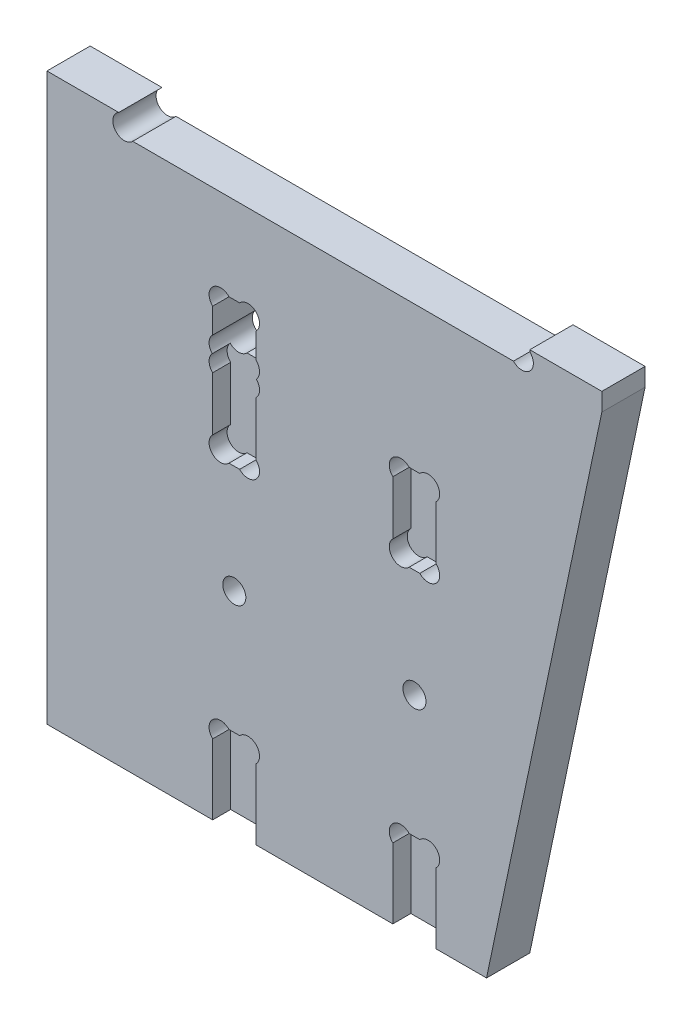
SolidWorks part; units mm, degrees
ref_plane "Plan de face" through (0, 0, 0) normal (0, 0, 1) x (1, 0, 0)
ref_plane "Plan de dessus" through (0, 0, 0) normal (0, 1, 0) x (1, 0, 0)
ref_plane "Plan de droite" through (0, 0, 0) normal (1, 0, 0) x (0, 0, -1)
sketch "Esquisse1" plane through (0, 0, 0) normal (0, 0, 1) x (1, 0, 0)
  line L0 (0, 65.0081) -> (0, -9.9384) construction
  line L1 (11.7393, 0) -> (-31.8718, 0) construction
  line L2 (9.1967, 12) -> (-23.9296, 12) construction
  line L3 (9.1967, 42) -> (-19.8178, 42) construction
  line L4 (9.1967, 54) -> (-19.8178, 54) construction
  line L5 (-6, 65.0081) -> (-6, -9.9384) construction
  line L6 (2.8612, 42) -> (2.8612, 12) construction
  line L7 (1.6817, 48) -> (-10.3124, 48) construction
  line L8 (-2.2619, 54) -> (-3.7381, 54) construction
  line L9 (0, 51.7381) -> (0, 44.2619)
  line L10 (-2.2619, 42) -> (-3.7381, 42)
  line L11 (-6, 51.7381) -> (-6, 44.2619)
  line L12 (-3, 54.8011) -> (-3, 40.0837) construction
  line L13 (2.8612, 27) -> (-11.4211, 27) construction
  line L14 (25.4842, 10) -> (-16.2282, 10) construction
  line L15 (-6, -2) -> (-6, 7.7381)
  line L16 (-3.7381, 10) -> (-2.2619, 10)
  line L17 (38.4169, -2) -> (-46.0794, -2) construction
  line L18 (17, 79.5439) -> (17, -29.3046) construction
  line L19 (-31, 83.2548) -> (-31, -44.3973) construction
  line L20 (57.319, 74) -> (-78.5779, 74) construction
  line L21 (23, 62.8857) -> (23, -51.6502) construction
  line L22 (30, 62.8857) -> (30, -54.9729) construction
  line L23 (-31, 0) -> (-31, 74)
  line L24 (30, -2) -> (46, 74)
  line L25 (33.7381, 74) -> (-19.0967, 74)
  line L26 (0, 7.7381) -> (0, -2)
  line L27 (0, -2) -> (17, -2)
  line L28 (17, -2) -> (17, 7.7381)
  line L29 (3.4839, 62) -> (-9.6947, 62) construction
  line L30 (0, 51.7381) -> (0, 59.7381)
  line L31 (-2.2619, 62) -> (-3.7381, 62)
  line L32 (-6, 59.7381) -> (-6, 51.7381)
  line L33 (17, 6.0366) -> (0, 6) construction
  line L34 (8.5, 9.2575) -> (8.5, 3.2101) construction
  line L35 (19.2619, 10) -> (20.7381, 10)
  line L36 (23, 7.7381) -> (23, -2)
  line L37 (23, -2) -> (30, -2)
  line L38 (-6, -2) -> (-31, -2)
  line L39 (17, 51.7381) -> (17, 44.2619)
  line L40 (23, 51.7381) -> (23, 44.2619)
  line L41 (19.2619, 42) -> (20.7381, 42)
  line L42 (20, 42) -> (20, 46.358) construction
  line L43 (20.7381, 54) -> (19.2619, 54)
  line L44 (20, 42) -> (20, 12) construction
  line L45 (-31, -2) -> (-31, 0)
  line L46 (-3, 10) -> (-3, 2.1006) construction
  line L47 (-42.5287, 80) -> (78.4783, 80) construction
  line L48 (-21, 86.0943) -> (-21, 72.2146) construction
  line L49 (7.3207, 75.5379) -> (7.3207, 90.5905) construction
  line L50 (36, 88.6356) -> (36, 76.2619) construction
  line L51 (-31, 74) -> (-31, 80)
  line L52 (-31, 80) -> (-21, 80)
  line L53 (-21, 80) -> (-21, 76.5178)
  line L54 (46, 74) -> (46, 80)
  line L55 (46, 80) -> (36, 80)
  line L56 (36, 80) -> (36, 76.2619)
  line L57 (36, 74) -> (36, 72.2146) construction
  arc A0 (0, 51.7381) -> (-2.2619, 54) centre (-1.1, 52.9) ccw construction
  arc A1 (0, 59.7381) -> (-2.2619, 62) centre (-1.1, 60.9) ccw
  arc A2 (-6, 44.2619) -> (-3.7381, 42) centre (-4.9, 43.1) ccw
  arc A3 (0, 44.2619) -> (-2.2619, 42) centre (-1.1, 43.1) cw
  arc A4 (-3.7381, 10) -> (-6, 7.7381) centre (-4.9, 8.9) ccw
  arc A5 (-2.2619, 10) -> (0, 7.7381) centre (-1.1, 8.9) cw
  arc A6 (-6, 59.7381) -> (-3.7381, 62) centre (-4.9, 60.9) cw
  arc A7 (20.7381, 10) -> (23, 7.7381) centre (21.9, 8.9) cw
  arc A8 (19.2619, 10) -> (17, 7.7381) centre (18.1, 8.9) ccw
  arc A9 (17, 51.7381) -> (19.2619, 54) centre (18.1, 52.9) cw construction
  arc A10 (23, 44.2619) -> (20.7381, 42) centre (21.9, 43.1) cw
  arc A11 (17, 44.2619) -> (19.2619, 42) centre (18.1, 43.1) ccw
  arc A12 (19.2619, 54) -> (17, 51.7381) centre (18.1, 52.9) ccw
  arc A13 (20.7381, 54) -> (23, 51.7381) centre (21.9, 52.9) cw
  circle A14 centre (20, 27) radius 1.6
  circle A15 centre (-3, 27) radius 1.6
  arc A16 (33.7381, 74) -> (36, 76.2619) centre (34.9, 75.1) ccw
  arc A17 (-19.0967, 74) -> (-21, 76.5178) centre (-20.2586, 75.1) cw
  dimension "D3" = 2
  dimension "D10" = 20
  dimension "D12" = 8
  dimension "D7" = 1.1
  dimension "D13" = 1.1
  dimension "D16" = 1.1
  dimension "D22" = 1.1
  dimension "D1" = 54
  dimension "D2" = 12
  dimension "D4" = 6
  dimension "D5" = 17
  dimension "D6" = 6
  dimension "D8" = 1.1
  dimension "D9" = 7
  dimension "D11" = 25
  dimension "D14" = 1.1
  dimension "D15" = 2
  dimension "D17" = 1.1
  dimension "D18" = 77
  dimension "D19" = 6
  dimension "D20" = 10
  dimension "D21" = 10
  dimension "D23" = 1.1
sketch "Esquisse2" plane through (0, 0, 0) normal (0, 0, 1) x (1, 0, 0)
  line L3 (-31, 80) -> (-21, 80) construction
  line L19 (-21, 80) -> (-21, 76.5178) construction
  line L20 (33.7381, 74) -> (-19.0967, 74) construction
  line L21 (36, 80) -> (36, 76.2619) construction
  line L22 (46, 80) -> (36, 80) construction
  line L23 (46, 74) -> (46, 80) construction
  line L24 (30, -2) -> (46, 74) construction
  line L25 (-31, 0) -> (-31, 74) construction
  line L26 (-31, 74) -> (-31, 80) construction
  line L27 (-31, -2) -> (-31, 0) construction
  line L28 (-6, -2) -> (-31, -2) construction
  line L29 (23, -2) -> (30, -2) construction
  line L30 (-31, 80) -> (-21, 80)
  line L31 (-21, 80) -> (-21, 76.5178)
  line L32 (33.7381, 74) -> (-19.0967, 74)
  line L33 (36, 80) -> (36, 76.2619)
  line L34 (46, 80) -> (36, 80)
  line L35 (46, 74) -> (46, 80)
  line L36 (30, -2) -> (46, 74)
  line L37 (-31, 0) -> (-31, 74)
  line L38 (-31, 74) -> (-31, 80)
  line L39 (-31, -2) -> (-31, 0)
  line L40 (-6, -2) -> (-31, -2)
  line L41 (23, -2) -> (30, -2)
  line L42 (23, -2) -> (-6, -2)
  arc A3 (-21, 76.5178) -> (-19.0967, 74) centre (-20.2586, 75.1) ccw construction
  arc A5 (33.7381, 74) -> (36, 76.2619) centre (34.9, 75.1) ccw construction
  arc A10 (-21, 76.5178) -> (-19.0967, 74) centre (-20.2586, 75.1) ccw
  arc A11 (33.7381, 74) -> (36, 76.2619) centre (34.9, 75.1) ccw
extrude "Boss.-Extru.1" add sketch "Esquisse2" against normal blind 6
sketch "Esquisse5" plane through (0, 0, 0) normal (0, 0, 1) x (1, 0, 0)
  circle A1 centre (20, 27) radius 1.6 construction
  circle A2 centre (-5, 27) radius 1.6
  circle A3 centre (20, 27) radius 1.6
extrude "Enlèv. mat.-Extru.3" cut sketch "Esquisse5" against normal through all
sketch "Esquisse6" plane through (0, 0, 0) normal (0, 0, 1) x (1, 0, 0)
  line L4 (20.7381, 54) -> (19.2619, 54) construction
  line L5 (23, 51.7381) -> (23, 44.2619) construction
  line L6 (17, 51.7381) -> (17, 44.2619) construction
  line L7 (19.2619, 42) -> (20.7381, 42) construction
  line L8 (-5.7381, 54) -> (-4.2619, 54)
  line L9 (-2, 51.7381) -> (-2, 44.2619)
  line L10 (-8, 51.7381) -> (-8, 44.2619)
  line L11 (-4.2619, 42) -> (-5.7381, 42)
  line L12 (20.7381, 54) -> (19.2619, 54)
  line L13 (23, 51.7381) -> (23, 44.2619)
  line L14 (17, 51.7381) -> (17, 44.2619)
  line L15 (19.2619, 42) -> (20.7381, 42)
  line L18 (-5, 47.4424) -> (-5, 57.5634) construction
  line L19 (19.2619, 10) -> (20.7381, 10) construction
  line L20 (23, 7.7381) -> (23, -2) construction
  line L21 (17, -2) -> (17, 7.7381) construction
  line L25 (19.2619, 10) -> (20.7381, 10)
  line L26 (23, 7.7381) -> (23, -2)
  line L27 (17, -2) -> (17, 7.7381)
  line L28 (-2, 7.7381) -> (-2, -2)
  line L29 (-8, -2) -> (-8, 7.7381)
  line L30 (-5.7381, 10) -> (-4.2619, 10)
  line L31 (-8, -2) -> (-8, -4.5)
  line L33 (-8, -4.5) -> (-2, -4.5)
  line L35 (-2, -4.5) -> (-2, -2)
  line L36 (-6, -2) -> (-31, -2) construction
  line L37 (17, -2) -> (17, -4.5)
  line L38 (17, 79.5439) -> (17, -29.3046) construction
  line L39 (17, -4.5) -> (23, -4.5)
  line L40 (23, 62.8857) -> (23, -51.6502) construction
  line L41 (23, -4.5) -> (23, -2)
  arc A2 (19.2619, 54) -> (17, 51.7381) centre (18.1, 52.9) ccw construction
  arc A3 (23, 51.7381) -> (20.7381, 54) centre (21.9, 52.9) ccw construction
  arc A4 (17, 44.2619) -> (19.2619, 42) centre (18.1, 43.1) ccw construction
  arc A5 (20.7381, 42) -> (23, 44.2619) centre (21.9, 43.1) ccw construction
  arc A6 (-8, 44.2619) -> (-5.7381, 42) centre (-6.9, 43.1) ccw
  arc A7 (-4.2619, 42) -> (-2, 44.2619) centre (-3.1, 43.1) ccw
  arc A8 (19.2619, 54) -> (17, 51.7381) centre (18.1, 52.9) ccw
  arc A9 (23, 51.7381) -> (20.7381, 54) centre (21.9, 52.9) ccw
  arc A10 (17, 44.2619) -> (19.2619, 42) centre (18.1, 43.1) ccw
  arc A11 (20.7381, 42) -> (23, 44.2619) centre (21.9, 43.1) ccw
  arc A13 (19.2619, 10) -> (17, 7.7381) centre (18.1, 8.9) ccw construction
  arc A14 (23, 7.7381) -> (20.7381, 10) centre (21.9, 8.9) ccw construction
  arc A17 (19.2619, 10) -> (17, 7.7381) centre (18.1, 8.9) ccw
  arc A18 (23, 7.7381) -> (20.7381, 10) centre (21.9, 8.9) ccw
  arc A19 (-2, 7.7381) -> (-4.2619, 10) centre (-3.1, 8.9) ccw
  arc A20 (-5.7381, 10) -> (-8, 7.7381) centre (-6.9, 8.9) ccw
  arc A21 (-2, 51.7381) -> (-4.2619, 54) centre (-3.1, 52.9) ccw
  arc A22 (-8, 51.7381) -> (-5.7381, 54) centre (-6.9, 52.9) cw
  dimension "D1" = 2.5
extrude "Enlèv. mat.-Extru.4" cut sketch "Esquisse6" against normal blind 2.5
sketch "Esquisse7" plane through (0, 0, 0) normal (0, 0, 1) x (1, 0, 0)
  line L0 (-5, 54) -> (-5, 62) construction
  line L5 (-8.424, 58) -> (-0.9868, 58) construction
  line L6 (-5.7381, 62) -> (-4.2619, 62)
  line L7 (-2, 59.7381) -> (-2, 56.2619)
  line L9 (-5.7381, 54) -> (-4.2619, 54)
  line L10 (-8, 59.7381) -> (-8, 56.2619)
  arc A0 (-2, 59.7381) -> (-4.2619, 62) centre (-3.1, 60.9) ccw
  arc A1 (-5.7381, 62) -> (-8, 59.7381) centre (-6.9, 60.9) ccw
  arc A2 (-5.7381, 54) -> (-8, 56.2619) centre (-6.9, 55.1) cw
  arc A3 (-4.2619, 54) -> (-2, 56.2619) centre (-3.1, 55.1) ccw
extrude "Enlèv. mat.-Extru.5" cut sketch "Esquisse7" against normal blind 10
sketch "Esquisse8" plane through (0, 0, 0) normal (0, 0, 1) x (1, 0, 0)
  line L0 (33.7381, 74) -> (-19.0967, 74) construction
  line L1 (-48.3684, 89.2996) -> (71.3082, 89.2996)
  line L2 (-48.3684, 89.2996) -> (-48.3684, 76.5)
  line L3 (-48.3684, 76.5) -> (71.3082, 76.5)
  line L4 (71.3082, 89.2996) -> (71.3082, 76.5)
  dimension "D1" = 2.5
extrude "Enlèv. mat.-Extru.6" cut sketch "Esquisse8" against normal blind 10
